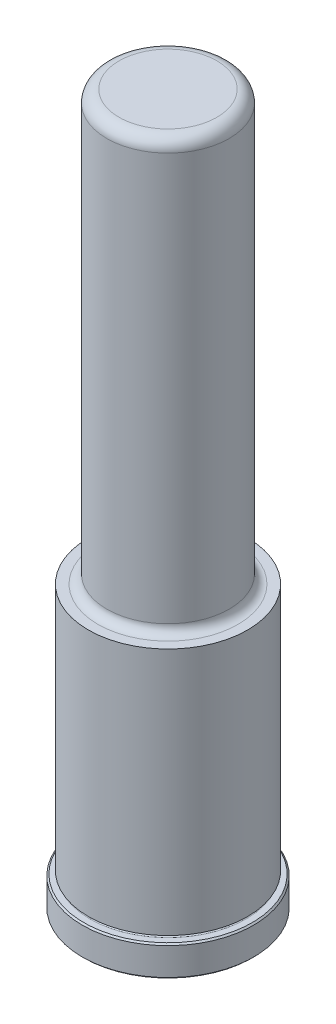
SolidWorks part; units mm, degrees
ref_plane "Front Plane" through (0, 0, 0) normal (0, 0, 1) x (1, 0, 0)
ref_plane "Top Plane" through (0, 0, 0) normal (0, 1, 0) x (1, 0, 0)
ref_plane "Right Plane" through (0, 0, 0) normal (1, 0, 0) x (0, 0, -1)
sketch "Sketch1" plane through (0, 0, 0) normal (1, 0, 0) x (0, 0, -1)
  line L0 (0, 0) -> (22.225, 0)
  line L1 (22.225, 0) -> (22.225, 7.9248)
  line L2 (22.225, 7.9248) -> (20.2438, 7.9248)
  line L3 (19.8628, 2.6782) -> (19.8628, 5.9795) construction
  line L4 (20.2438, 8.6868) -> (20.6502, 8.6868)
  line L5 (20.6502, 8.6868) -> (20.6502, 73.025)
  line L6 (20.6502, 73.025) -> (18.1483, 73.025)
  line L7 (15.8623, 75.311) -> (15.8623, 184.15)
  line L9 (15.8623, 184.15) -> (0, 184.15)
  line L10 (0, 184.15) -> (0, 0)
  line L11 (0, 0) -> (0, -7.2694) construction
  arc A0 (20.2438, 8.6868) -> (20.2438, 7.9248) centre (20.2438, 8.3058) ccw
  arc A1 (18.1483, 73.025) -> (15.8623, 75.311) centre (18.1483, 75.311) cw
  point P2 (15.8623, 184.15)
  point P14 (15.8623, 183.9666)
  point P19 (15.8623, 73.025)
  dimension "D14" = 0.762
  dimension "D8" = 2.286
  dimension "T" = 7.9248
  dimension "D2" = 0.762
  dimension "M" = 44.45
  dimension "B" = 41.3004
  dimension "L" = 184.15
  dimension "D7" = 0.7874
  dimension "A" = 73.025
  dimension "D" = 31.7246
  dimension "D15" = 111.125
revolve "Revolve1" add sketch "Sketch1" angle 360 about L11
chamfer "Chamfer1" distance 0.381 angle 45 2 edges at (0, 0, 22.225) (0, 7.9248, 22.225)
fillet "Fillet7" radius 3.175 1 edges at (0, 184.15, 15.8623)
